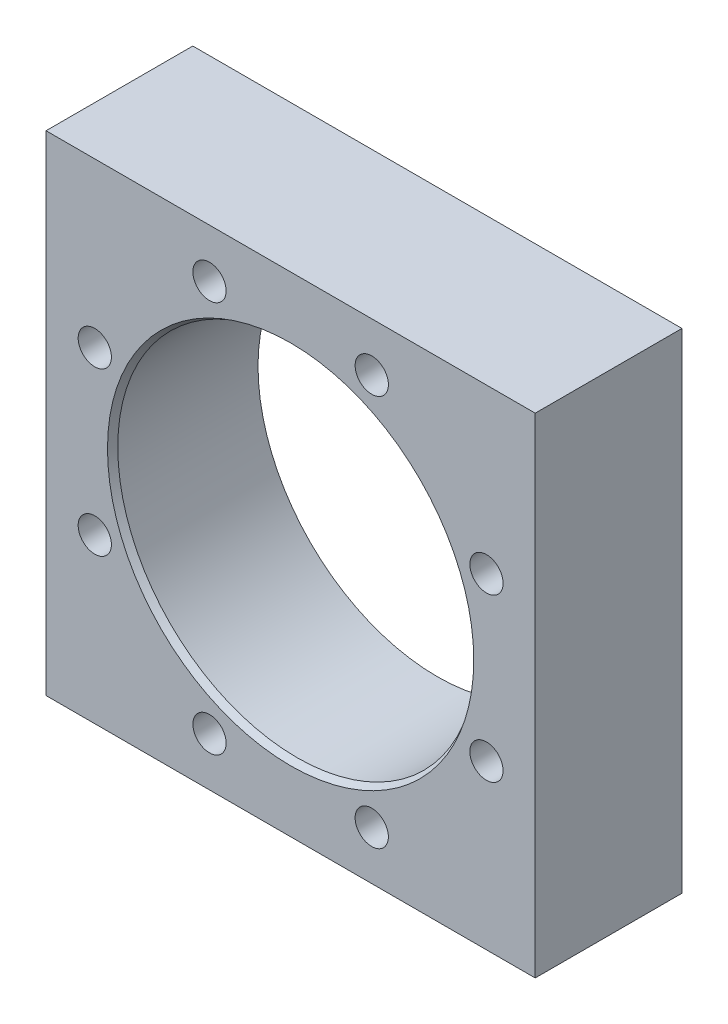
SolidWorks part; units mm, degrees
ref_plane "Plan de face" through (0, 0, 0) normal (0, 0, 1) x (1, 0, 0)
ref_plane "Plan de dessus" through (0, 0, 0) normal (0, 1, 0) x (1, 0, 0)
ref_plane "Plan de droite" through (0, 0, 0) normal (1, 0, 0) x (0, 0, -1)
sketch "Esquisse1" plane through (0, 0, 0) normal (0, 0, 1) x (1, 0, 0)
  line L1 (0, 0) -> (150, 0)
  line L2 (0, 0) -> (0, 150)
  line L3 (0, 150) -> (150, 150)
  line L4 (150, 0) -> (150, 150)
  circle A0 centre (75, 75) radius 55
  dimension "D3" = 110
  dimension "D1" = 150
  dimension "D2" = 150
  dimension "D4" = 75
  dimension "D5" = 75
extrude "Extrusion1" add sketch "Esquisse1" along normal blind 45
hole_wizard "Trou taraudé M12x1.751" positions "Esquisse3D1" profile "Esquisse2" tap size "M12x1.75" standard "Ansi Métrique"
sketch3d "Esquisse3D1"
  line L0 (75, 75, 45) -> (99.8744, 135.0522, 45) construction
  line L1 (75, 75, 45) -> (75, 75, 0) construction
  line L3 (75, 75, 45) -> (75, 167.3923, 45) construction
  point P0 (99.8744, 135.0522, 45)
  dimension "D1" = 22.5
  dimension "D2" = 65
sketch "Esquisse2" plane through (99.8744, 135.0522, 45) normal (1, 0, 0) x (0, -1, 0)
  line L0 (0, 0) -> (0, 38.0644)
  line L1 (0, 38.0644) -> (5.1, 35)
  line L2 (5.1, 35) -> (5.1, 0)
  line L5 (5.1, 0) -> (0, 0)
  line L10 (0, 38.0644) -> (-5.1, 35) construction
  line L11 (0, -6.35) -> (0, 107.95) construction
  dimension "Diamètre du trou pour taraudage" = 10.2
  dimension "Profondeur du trou pour taraudage" = 35
  dimension "Angle de pointe" = 118
pattern_circular "Répétition circulaire1" count 8 over 360 about axis through (75, 75, 0) along (0, 0, 1) of "Trou taraudé M12x1.751"
chamfer "Chanfrein1" distance 2 angle 30 1 edges at (130, 75, 45)
